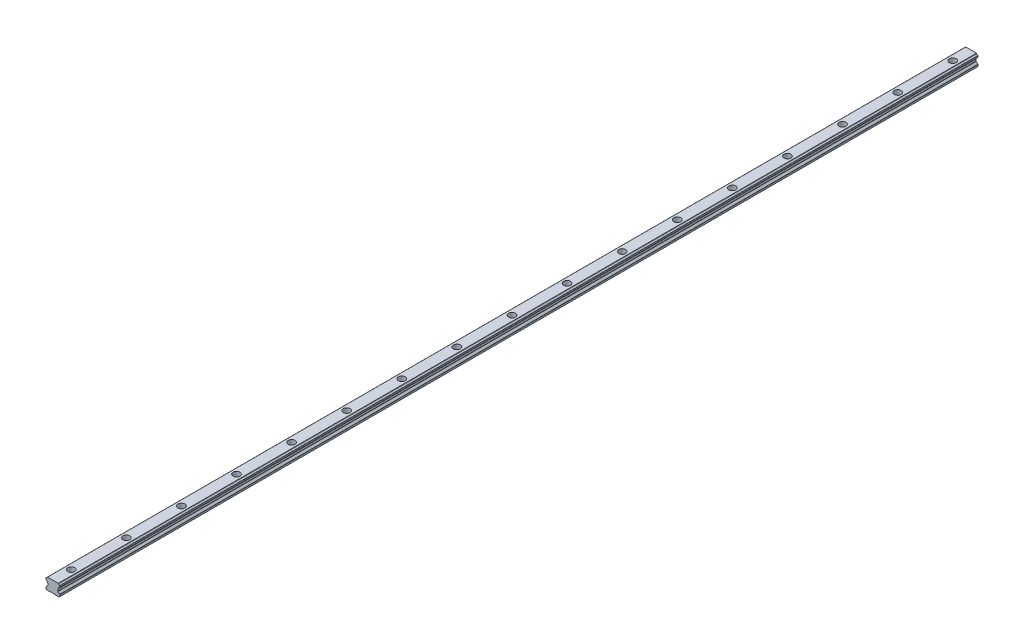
SolidWorks part; units mm, degrees
ref_plane "Front Plane" through (0, 0, 0) normal (0, 0, 1) x (1, 0, 0)
ref_plane "Top Plane" through (0, 0, 0) normal (0, 1, 0) x (1, 0, 0)
ref_plane "Right Plane" through (0, 0, 0) normal (1, 0, 0) x (0, 0, -1)
sketch "Sketch2" plane through (0, 0, 0) normal (0, 0, 1) x (1, 0, 0)
  line L0 (6.0951, 6.5542) -> (-5.566, 6.5542)
  line L1 (-7.2355, 4.8848) -> (-7.2355, 3.4237)
  line L2 (-5.7649, 1.6899) -> (-5.3233, 1.2483)
  line L3 (-5.2355, 1.0362) -> (-5.2355, -1.1215)
  line L4 (-5.3233, -1.3336) -> (-7.089, -3.0993)
  line L5 (-7.2355, -3.4529) -> (-7.2355, -5.2457)
  line L6 (-7.2355, -5.2457) -> (-6.5355, -5.9458)
  line L7 (-6.5355, -5.9458) -> (-2.0855, -5.9458)
  line L8 (-2.0855, -5.9458) -> (-1.7855, -5.6458)
  line L9 (-1.7855, -5.6458) -> (2.3145, -5.6458)
  line L10 (2.3145, -5.6458) -> (2.6145, -5.9458)
  line L11 (2.6145, -5.9458) -> (7.0645, -5.9458)
  line L12 (7.0645, -5.9458) -> (7.7645, -5.2457)
  line L13 (7.7645, -5.2457) -> (7.7645, -3.4528)
  line L14 (7.6181, -3.0993) -> (5.8524, -1.3336)
  line L15 (5.7645, -1.1215) -> (5.7645, 1.0362)
  line L16 (5.8524, 1.2483) -> (6.2939, 1.6899)
  line L17 (7.7645, 3.4237) -> (7.7645, 4.8848)
  arc A0 (6.2974, 6.4758) -> (6.0951, 6.5542) centre (6.0951, 6.2542) ccw
  arc A1 (-5.566, 6.5542) -> (-5.7683, 6.4758) centre (-5.566, 6.2542) ccw
  arc A2 (-7.157, 5.0871) -> (-5.7683, 6.4758) centre (-7.2645, 6.5832) ccw
  arc A3 (-7.157, 5.0871) -> (-7.2355, 4.8848) centre (-6.9355, 4.8848) ccw
  arc A4 (-7.2355, 3.4237) -> (-7.157, 3.2214) centre (-6.9355, 3.4237) ccw
  arc A5 (-5.7645, 1.7253) -> (-7.157, 3.2214) centre (-7.2645, 1.7253) ccw
  arc A6 (-5.7649, 1.6899) -> (-5.7645, 1.7253) centre (-7.2645, 1.7253) ccw
  arc A7 (-5.2355, 1.0362) -> (-5.3233, 1.2483) centre (-5.5355, 1.0362) ccw
  arc A8 (-5.3233, -1.3336) -> (-5.2355, -1.1215) centre (-5.5355, -1.1215) ccw
  arc A9 (-7.089, -3.0993) -> (-7.2355, -3.4529) centre (-6.7355, -3.4529) ccw
  arc A10 (7.7645, -3.4528) -> (7.6181, -3.0993) centre (7.2645, -3.4529) ccw
  arc A11 (5.7645, -1.1215) -> (5.8524, -1.3336) centre (6.0645, -1.1215) ccw
  arc A12 (5.8524, 1.2483) -> (5.7645, 1.0362) centre (6.0645, 1.0362) ccw
  arc A13 (7.6861, 3.2214) -> (6.2939, 1.6899) centre (7.7935, 1.7253) ccw
  arc A14 (7.6861, 3.2214) -> (7.7645, 3.4237) centre (7.4645, 3.4237) ccw
  arc A15 (7.7645, 4.8848) -> (7.6861, 5.0871) centre (7.4645, 4.8848) ccw
  arc A16 (6.2974, 6.4758) -> (7.6861, 5.0871) centre (7.7935, 6.5832) ccw
extrude "Boss-Extrude1" add sketch "Sketch2" along normal blind 1000
sketch "Sketch3" plane through (0, 6.5542, 0) normal (0, 1, 0) x (1, 0, 0)
  line L0 (7.7645, -1000) -> (7.7645, 0) construction
  line L2 (6.0951, 0) -> (-5.566, 0) construction
  point P0 (0.2645, -20)
  dimension "D1" = 7.5
  dimension "D2" = 20
hole_wizard "CBORE for M16 Hex Head Bolt1" positions "Sketch3" profile "Sketch4" counterbore size "M16" standard "DIN"
sketch "Sketch4" plane through (0.2645, 6.5542, 20) normal (1, 0, 0) x (0, 0, 1)
  line L0 (0, 0) -> (0, 12.5)
  line L1 (0, 12.5) -> (2.25, 12.5)
  line L3 (2.25, 12.5) -> (2.25, 5.3)
  line L4 (2.25, 5.3) -> (3.75, 5.3)
  line L5 (3.75, 5.3) -> (3.75, 0)
  line L7 (3.75, 0) -> (0, 0)
  line L11 (0, -6.35) -> (0, 107.95) construction
  dimension "Thru Hole Dia." = 4.5
  dimension "Thru Hole Depth" = 12.5
  dimension "C'Bore Dia." = 7.5
  dimension "C'Bore Depth" = 5.3
other "Fill Pattern1" parameters "D5"=0, "D6"=0, "D1"=60, "D2"=60, "D3"=0, "D9"=17, "D7"=17, "D8"=2
